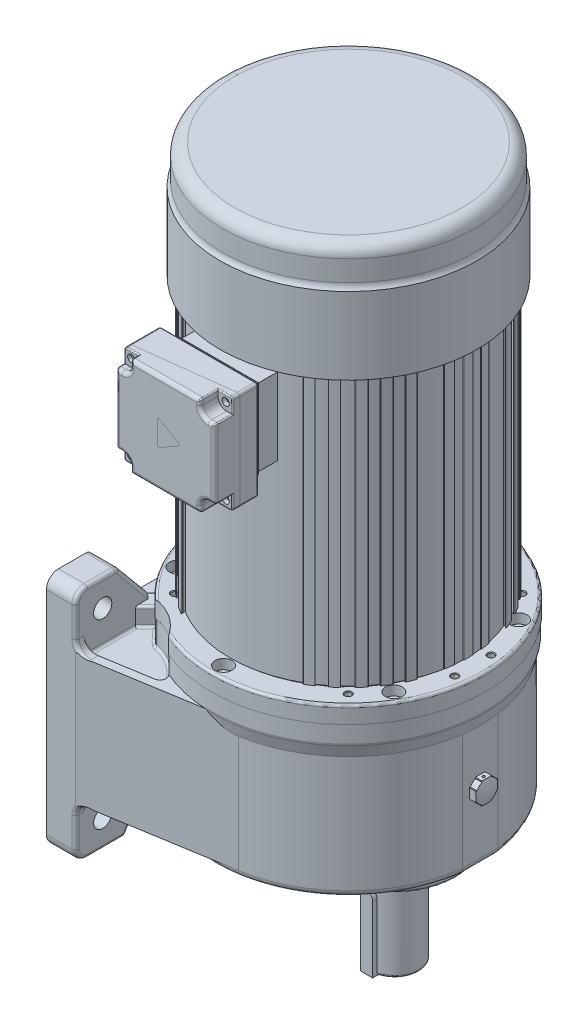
SolidWorks part; units mm, degrees
ref_plane "前视基准面" through (0, 0, 0) normal (0, 0, 1) x (1, 0, 0)
ref_plane "上视基准面" through (0, 0, 0) normal (0, 1, 0) x (1, 0, 0)
ref_plane "右视基准面" through (0, 0, 0) normal (1, 0, 0) x (0, 0, -1)
imported_body "接线盒座-1-surface1"
imported_body "接线盒座-1-surface2"
imported_body "接线盒座-1-surface3"
imported_body "接线盒座-1-surface4"
imported_body "接线盒座-1-surface5"
imported_body "接线盒座-1-surface6"
imported_body "接线盒盖-1-surface1"
imported_body "接线盒盖-1-surface2"
imported_body "接线盒盖-1-surface3"
imported_body "15.04.12 40卧式箱体D版-1-surface1"
imported_body "15.04.12 40卧式箱体D版-1-surface2"
imported_body "15.04.12 40卧式箱体D版-1-surface3"
imported_body "15.04.12 40卧式箱体D版-1-surface4"
imported_body "15.04.12 40卧式箱体D版-1-surface5"
imported_body "15.07.07 40箱盖(新)-1-surface1"
imported_body "复件 5034.2200.106-00-1-surface1"
imported_body "复件 5034.2200.106-00-1-surface2"
imported_body "复件 5034.2200.106-00-1-surface3"
imported_body "复件 5034.2200.106-00-1-surface4"
imported_body "复件 5034.2200.106-00-1-surface5"
imported_body "复件 5034.2200.106-00-1-surface6"
imported_body "复件 5034.2200.106-00-1-surface7"
imported_body "复件 5034.2200.106-00-1-surface8"
imported_body "复件 5034.2200.106-00-1-surface9"
imported_body "复件 5034.2200.106-00-1-surface10"
imported_body "复件 5034.2200.106-00-1-surface11"
imported_body "复件 5034.2200.106-00-1-surface12"
imported_body "复件 5034.2200.106-00-1-surface13"
imported_body "复件 5034.2200.106-00-1-surface14"
imported_body "复件 5034.2200.106-00-1-surface15"
imported_body "复件 5034.2200.106-00-1-surface16"
imported_body "复件 5034.2200.106-00-1-surface17"
imported_body "复件 5034.2200.106-00-1-surface18"
imported_body "复件 5034.2200.106-00-1-surface19"
imported_body "复件 5034.2200.106-00-1-surface20"
imported_body "复件 5034.2200.106-00-1-surface21"
imported_body "复件 5034.2200.106-00-1-surface22"
imported_body "复件 5034.2200.106-00-1-surface24"
imported_body "复件 5034.2200.106-00-1-surface25"
imported_body "复件 5034.2200.106-00-1-surface26"
imported_body "复件 5034.2200.106-00-1-surface27"
imported_body "复件 5034.2200.106-00-1-surface28"
imported_body "复件 5034.2200.106-00-1-surface29"
imported_body "复件 5034.2200.106-00-1-surface30"
imported_body "复件 5034.2200.106-00-1-surface31"
imported_body "复件 5034.2200.106-00-1-surface32"
imported_body "复件 5034.2200.106-00-1-surface33"
imported_body "复件 5034.2200.106-00-1-surface34"
imported_body "复件 5034.2200.106-00-1-surface35"
imported_body "复件 5034.2200.106-00-1-surface36"
imported_body "复件 5034.2200.106-00-1-surface37"
imported_body "复件 5034.2200.106-00-1-surface38"
imported_body "复件 5034.2200.106-00-1-surface39"
imported_body "复件 5034.2200.106-00-1-surface40"
imported_body "复件 5034.2200.106-00-1-surface41"
imported_body "复件 5034.2200.106-00-1-surface42"
imported_body "复件 5034.2200.106-00-1-surface43"
imported_body "复件 5034.2200.106-00-1-surface44"
imported_body "复件 5034.2200.106-00-1-surface45"
imported_body "复件 5034.2200.106-00-1-surface46"
imported_body "复件 5034.2200.106-00-1-surface47"
imported_body "复件 5034.2200.106-00-1-surface48"
imported_body "复件 5034.2200.106-00-1-surface49"
imported_body "复件 5034.2200.106-00-1-surface50"
imported_body "复件 5034.2200.106-00-1-surface51"
imported_body "复件 5034.2200.106-00-1-surface52"
imported_body "复件 5034.2200.106-00-1-surface53"
imported_body "复件 5034.2200.106-00-1-surface54"
imported_body "复件 5034.2200.106-00-1-surface55"
imported_body "复件 5034.2200.106-00-1-surface56"
imported_body "复件 5034.2200.106-00-1-surface57"
imported_body "透气塞-1-surface1"
sketch "草图2" plane through (0, -205.7215, 0) normal (0, 1, 0) x (1, 0, 0)
  circle A0 centre (514.641, 74.8421) radius 98
  circle A1 centre (552.641, 74.8421) radius 38 construction
extrude "凸台-拉伸1" add sketch "草图2" along normal blind 224.5
sketch "草图3" plane through (0, 18.7785, 0) normal (0, 1, 0) x (1, 0, 0)
  circle A0 centre (514.641, 74.8421) radius 106
extrude "凸台-拉伸2" add sketch "草图3" along normal blind 63.5
sketch "草图4" plane through (0, 82.2785, 0) normal (0, 1, 0) x (1, 0, 0)
  circle A0 centre (514.641, 74.8421) radius 104
extrude "凸台-拉伸3" add sketch "草图4" along normal blind 32
fillet "圆角1" radius 7 1 edges at (514.641, 82.2785, 29.1579)
fillet "圆角2" radius 10 1 edges at (514.641, 114.2785, 29.1579)
